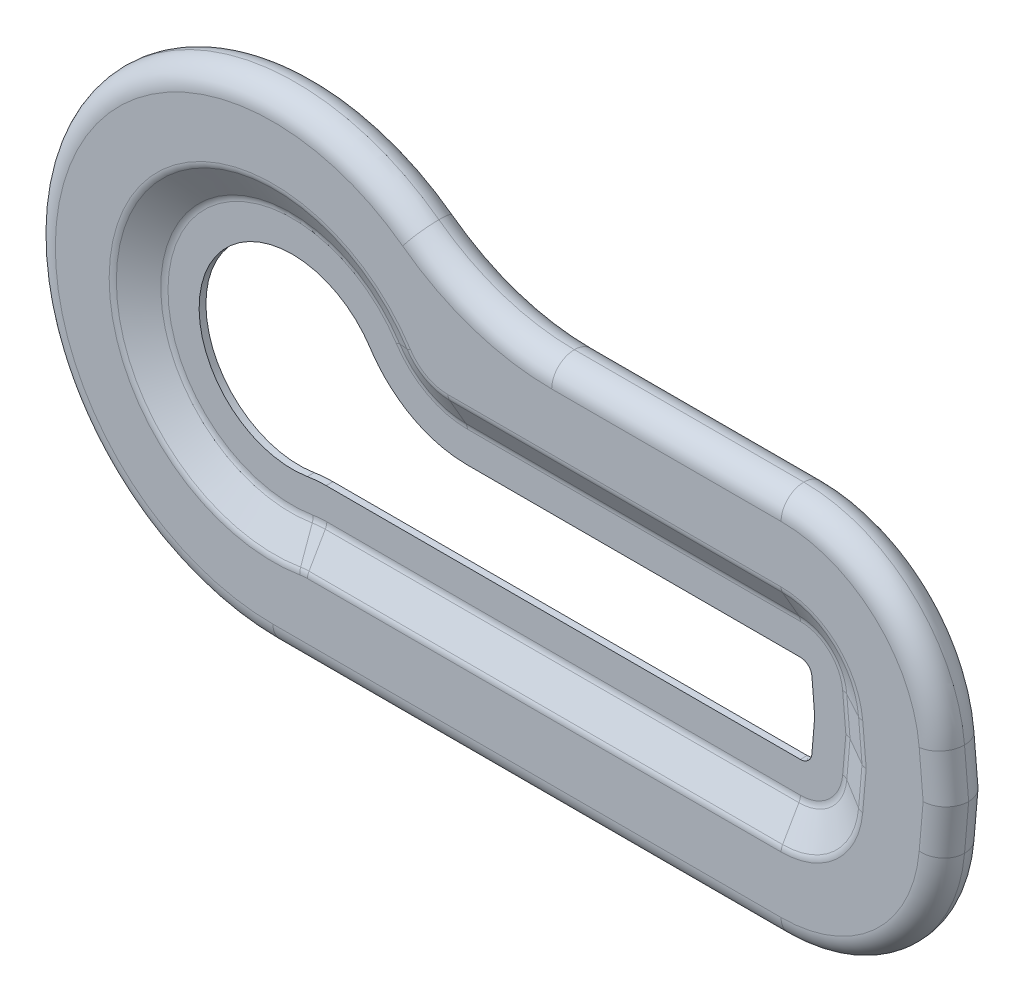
SolidWorks part; units mm, degrees
ref_plane "Plan1" through (0, 0, 0) normal (0, 0, 1) x (1, 0, 0)
ref_plane "Plan2" through (0, 0, 0) normal (0, 1, 0) x (1, 0, 0)
ref_plane "Plan3" through (0, 0, 0) normal (1, 0, 0) x (0, 0, -1)
sketch "Esquisse1" plane through (0, 0, 0) normal (0, 0, 1) x (1, 0, 0)
  circle A0 centre (0, 0) radius 16.2
  dimension "D1" = 32.4
extrude "Base-Extrusion" add sketch "Esquisse1" along normal mid plane 16.3 draft 4
sketch "Esquisse2" plane through (0, 0, 0) normal (0, 0, 1) x (1, 0, 0)
  line L0 (-20, 0) -> (20, 0) construction
  line L1 (-20, -8) -> (94.3291, -8) construction
  line L2 (0, -15.7) -> (88.1673, -15.7)
  line L3 (90.1597, -13.8743) -> (90.6737, -8)
  line L4 (0, -15.7) -> (0, -8)
  line L5 (0, -8) -> (90.6737, -8)
  circle A0 centre (0, 0) radius 15.6301 construction
  arc A1 (90.1597, -13.8743) -> (88.1673, -15.7) centre (88.1673, -13.7) cw
  point P13 (90, -15.7)
  dimension "D5" = 2
  dimension "D1" = 8
  dimension "D2" = 7.7
  dimension "D3" = 95
  dimension "D4" = 90
revolve "Boss.-Révol.1" add sketch "Esquisse2" angle 360 about L1
fillet "Congé4" radius 1
fillet "Congé5" radius 20
sketch "Esquisse3" plane through (0, 0, 0) normal (0, 1, 0) x (1, 0, 0)
  line L0 (0, 20.6238) -> (0, -15.1969) construction
  line L1 (0, 0) -> (0, -7.2198) construction
  line L2 (11.7426, -8.15) -> (0, -8.15)
  line L3 (0, 2.85) -> (0, -8.15)
  line L4 (-14.6976, -8.15) -> (14.6976, -8.15) construction
  line L5 (9, 2.85) -> (11.7426, -8.15)
  line L7 (-32.9547, 0) -> (48.0586, 0) construction
  line L8 (-20, 0) -> (94.3291, 0) construction
  line L9 (0, 2.85) -> (9, 2.85)
  dimension "D2" = 9
  dimension "D1" = 14
  dimension "D4" = 11
revolve "Enlèvement de matière-Révolution1" cut sketch "Esquisse3" angle 360 about L0
fillet "Congé13" radius 5
fillet "Congé15" radius 2
sketch "Esquisse5" plane through (0, 0, 0) normal (0, 1, 0) x (1, 0, 0)
  line L0 (0, 16.1009) -> (0, -12.7842) construction
  line L1 (0, 0) -> (0, -7.2198) construction
  line L2 (0, 5.15) -> (10.8, 5.15)
  line L4 (0, 8.15) -> (0, 5.15)
  line L5 (10.8, 5.15) -> (11.548, 8.15)
  line L6 (11.548, 8.15) -> (0, 8.15)
  line L7 (14.6976, 8.15) -> (-14.6976, 8.15) construction
  dimension "D3" = 14
  dimension "D2" = 10.8
  dimension "D1" = 3
revolve "Enlèvement de matière-Révolution2" cut sketch "Esquisse5" angle 360 about L0
fillet "Congé16" radius 2
fillet "Congé17" radius 2
scale "Echelle1"
sketch "Esquisse7" plane through (0, 0, 0) normal (0, 0, 1) x (1, 0, 0)
  line L0 (97.4644, -1.6368) -> (98.0316, -8.12)
  line L1 (97.4644, -14.6032) -> (98.0316, -8.12)
  line L24 (6.0879, -21.9105) -> (89.4898, -21.9105)
  line L25 (89.4898, 5.6705) -> (30.8393, 5.6705)
  arc A0 (3.7119, -22.1086) -> (6.0879, -21.9105) centre (6.0879, -36.2605) cw
  arc A1 (18.8032, 12.2068) -> (30.8393, 5.6705) centre (30.8393, 20.0205) ccw
  circle A2 centre (0, 0) radius 14
  arc A15 (89.4898, -21.9105) -> (97.4644, -14.6032) centre (89.4898, -13.9055) ccw
  arc A16 (18.8032, 12.2068) -> (3.7119, -22.1086) centre (0, 0) ccw
  arc A17 (97.4644, -1.6368) -> (89.4898, 5.6705) centre (89.4898, -2.3345) ccw
  dimension "D2" = 14.35
  dimension "D3" = 14.35
  dimension "D1" = 28
  dimension "D4" = 170
extrude "Boss.-Extru.1" add sketch "Esquisse7" along normal mid plane 1.2
sketch "Esquisse8" plane through (0, 0, 0) normal (0, 0, 1) x (1, 0, 0)
  line L0 (0, 0) -> (0, -82.1677) construction
  line L1 (0, -42.3205) -> (89.4898, -42.3205)
  line L16 (117.7967, -16.382) -> (118.5196, -8.12)
  line L17 (118.5196, -8.12) -> (117.7967, 0.142)
  line L18 (89.4898, 26.0805) -> (49.0921, 26.0805)
  line L20 (97.4644, -14.6032) -> (98.0316, -8.12)
  line L21 (98.0316, -8.12) -> (97.4644, -1.6368)
  line L22 (89.4898, 5.6705) -> (30.8393, 5.6705)
  line L23 (6.0879, -21.9105) -> (89.4898, -21.9105)
  line L24 (97.4644, -14.6032) -> (98.0316, -8.12)
  line L25 (98.0316, -8.12) -> (97.4644, -1.6368)
  line L26 (89.4898, 5.6705) -> (30.8393, 5.6705)
  line L27 (6.0879, -21.9105) -> (89.4898, -21.9105)
  arc A0 (25.238, 33.9716) -> (0, -42.3205) centre (0, 0) ccw
  arc A1 (49.0921, 26.0805) -> (25.238, 33.9716) centre (49.0921, 66.0805) cw
  arc A18 (89.4898, -42.3205) -> (117.7967, -16.382) centre (89.4898, -13.9055) ccw
  arc A19 (117.7967, 0.142) -> (89.4898, 26.0805) centre (89.4898, -2.3345) ccw
  arc A21 (89.4898, -21.9105) -> (97.4644, -14.6032) centre (89.4898, -13.9055) ccw
  arc A22 (97.4644, -1.6368) -> (89.4898, 5.6705) centre (89.4898, -2.3345) ccw
  arc A23 (18.8032, 12.2068) -> (30.8393, 5.6705) centre (30.8393, 20.0205) ccw
  arc A24 (18.8032, 12.2068) -> (3.7119, -22.1086) centre (0, 0) ccw
  arc A25 (6.0879, -21.9105) -> (3.7119, -22.1086) centre (6.0879, -36.2605) ccw
  arc A26 (89.4898, -21.9105) -> (97.4644, -14.6032) centre (89.4898, -13.9055) ccw
  arc A27 (97.4644, -1.6368) -> (89.4898, 5.6705) centre (89.4898, -2.3345) ccw
  arc A28 (18.8032, 12.2068) -> (30.8393, 5.6705) centre (30.8393, 20.0205) ccw
  arc A29 (18.8032, 12.2068) -> (3.7119, -22.1086) centre (0, 0) ccw
  arc A30 (6.0879, -21.9105) -> (3.7119, -22.1086) centre (6.0879, -36.2605) ccw
  dimension "D2" = 0
  dimension "D1" = 28.415
  dimension "D3" = 28.415
  dimension "D4" = 40
extrude "Boss.-Extru.2" add sketch "Esquisse8" along normal mid plane 8
fillet "Congé9" radius 4
fillet "Congé10" radius 4
draft "Dépouille1" type of draft neutral plane draft angle 60 faces to draft 9 parameters "D1"=60
draft "Dépouille3" type of draft neutral plane draft angle 60 faces to draft 9 parameters "D1"=60
fillet "Congé11" radius 2
fillet "Congé12" radius 2
sketch "Esquisse9" plane through (0, 0, 0) normal (0, 0, 1) x (1, 0, 0)
  line L0 (30.7588, -0.3276) -> (89.4898, -0.3276) construction
  line L1 (89.4898, -15.9124) -> (5.967, -15.9124) construction
  line L2 (30.7588, -0.3276) -> (89.4898, -0.3276)
  line L3 (89.4898, -15.9124) -> (5.967, -15.9124)
  arc A0 (13.7663, 8.9153) -> (2.6687, -16.1825) centre (0, 0) ccw construction
  arc A1 (13.7663, 8.9153) -> (2.6687, -16.1825) centre (0, 0) ccw
  point P7 (91.5121, -2.1878)
  point P8 (91.5121, -14.0522)
extrude "Enlèv. mat.-Extru.1" cut sketch "Esquisse9" against normal mid plane 30
